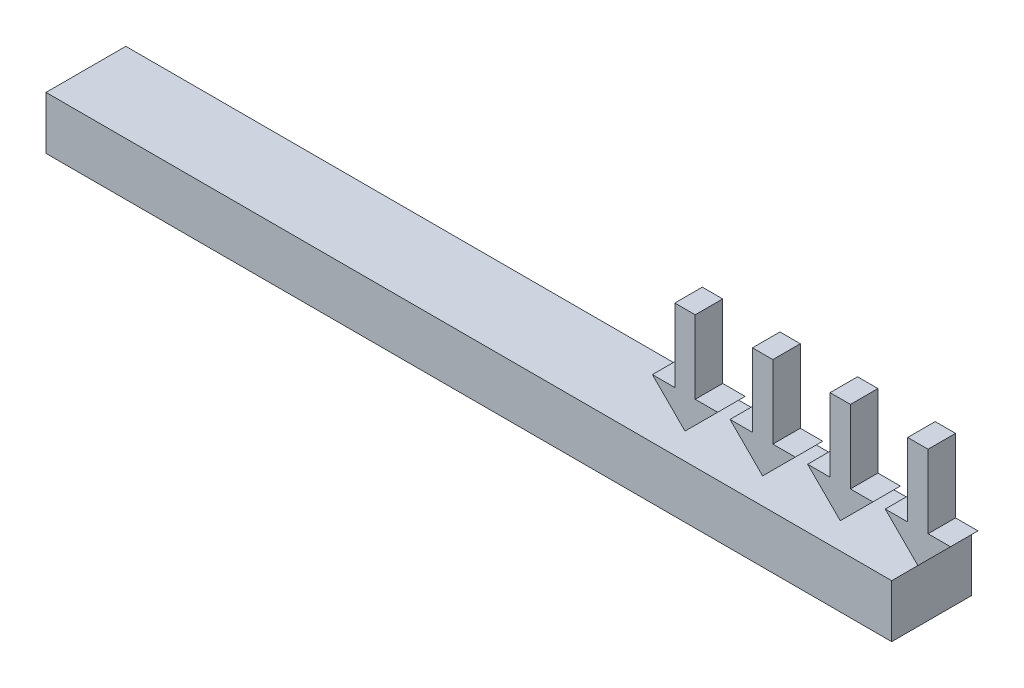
SolidWorks part; units mm, degrees
ref_plane "Front Plane" through (0, 0, 0) normal (0, 0, 1) x (1, 0, 0)
ref_plane "Top Plane" through (0, 0, 0) normal (0, 1, 0) x (1, 0, 0)
ref_plane "Right Plane" through (0, 0, 0) normal (1, 0, 0) x (0, 0, -1)
sketch "Sketch1" plane through (0, 0, 0) normal (0, 0, 1) x (1, 0, 0)
  line L0 (330.1996, -304.2831) -> (304.7996, -304.3228) construction
  line L1 (0, 0) -> (406.4, 0)
  line L2 (0, 0) -> (0, 25.4)
  line L3 (0, 25.4) -> (406.4, 25.4)
  line L4 (406.4, 0) -> (406.4, 25.4)
  line L5 (0, 25.4) -> (0, 0) construction
  arc A0 (0, 25.4) -> (330.1996, -304.2831) centre (0, -304.8) cw construction
  arc A1 (0, 0) -> (304.7996, -304.3228) centre (0, -304.8) cw construction
  dimension "D2" = 304.8
  dimension "D1" = 25.4
  dimension "D3" = 406.4
  dimension "length" = 518.16
extrude "Extrude1" add sketch "Sketch1" along normal mid plane 38.354
sketch "Sketch2" plane through (0, 0, 0) normal (0, 0, 1) x (1, 0, 0)
  line L0 (401.502, 41.0825) -> (390.7175, 41.0825)
  line L1 (401.502, 76.2654) -> (411.298, 76.2654)
  line L2 (401.502, 76.2654) -> (401.502, 41.0825)
  line L3 (390.7175, 41.0825) -> (406.4, 25.4)
  line L4 (411.298, 76.2654) -> (411.298, 41.0825)
  line L5 (406.4, 25.4) -> (0, 25.4) construction
  line L6 (406.4, 25.4) -> (422.0825, 41.0825)
  line L7 (422.0825, 41.0825) -> (411.298, 41.0825)
  line L8 (406.4, 76.2654) -> (406.4, 25.4) construction
  line L9 (406.4, 0) -> (406.4, 25.4) construction
extrude "Extrude2" add sketch "Sketch2" along normal mid plane 13.208 separate body
pattern_linear "LPattern2" count 4 spacing 37.3 along (-1, 0, 0)
sketch "Sketch3" plane through (0, 0, 0) normal (0, 0, 1) x (1, 0, 0)
  line L0 (0, 0) -> (0, 25.4) construction
  line L1 (330.1996, -304.2831) -> (304.7996, -304.3228) construction
  line L2 (0, 0) -> (0, 25.4)
  line L3 (330.1996, -304.2831) -> (304.7996, -304.3228)
  arc A0 (304.7996, -304.3228) -> (0, 0) centre (0, -304.8) ccw construction
  arc A1 (330.1996, -304.2831) -> (0, 25.4) centre (0, -304.8) ccw construction
  arc A2 (304.7996, -304.3228) -> (0, 0) centre (0, -304.8) ccw
  arc A3 (330.1996, -304.2831) -> (0, 25.4) centre (0, -304.8) ccw
extrude "Extrude3" [suppressed] add sketch "Sketch3" along normal up to vertex and the other way up to vertex separate body
delete or keep bodies "Body-Delete1" [suppressed] type delete bodies bodies 101
move or copy body "Body-Move/Copy1" [suppressed] bodies to move or copy 102 103 104 105
move or copy body "Body-Move/Copy4" [suppressed] bodies to move or copy 110 109 108 107
move or copy body "Body-Move/Copy5" [suppressed] bodies to move or copy 119 120 121 122
sketch "Sketch4" [suppressed] plane through (0, 0, 19.177) normal (0, 0, 1) x (1, 0, 0)
  line L0 (287.3489, -203.1453) -> (311.2946, -194.6741)
  line L1 (311.2946, -194.6741) -> (342.0086, -281.4939) construction
  arc A0 (304.7996, -304.3228) -> (0, 0) centre (0, -304.8) ccw construction
  arc A1 (330.1996, -304.2831) -> (0, 25.4) centre (0, -304.8) ccw construction
  dimension "D1" = 406.4
extrude "Cut-Extrude1" [suppressed] cut sketch "Sketch4" against normal through all and the other way through all flip side to cut
sketch "Sketch5" [suppressed] plane through (0, 0, 19.177) normal (0, 0, 1) x (1, 0, 0)
  line L0 (304.7996, -304.3228) -> (330.1996, -304.2831) construction
  line L1 (0, 0) -> (299.6156, -304.2938)
  line L2 (299.6156, -304.2938) -> (323.3601, -304.2938)
  arc A0 (0, 0) -> (323.3601, -304.2938) centre (-0.0412, -324.0012) cw
extrude "Cut-Extrude2" [suppressed] cut sketch "Sketch5" against normal through all
